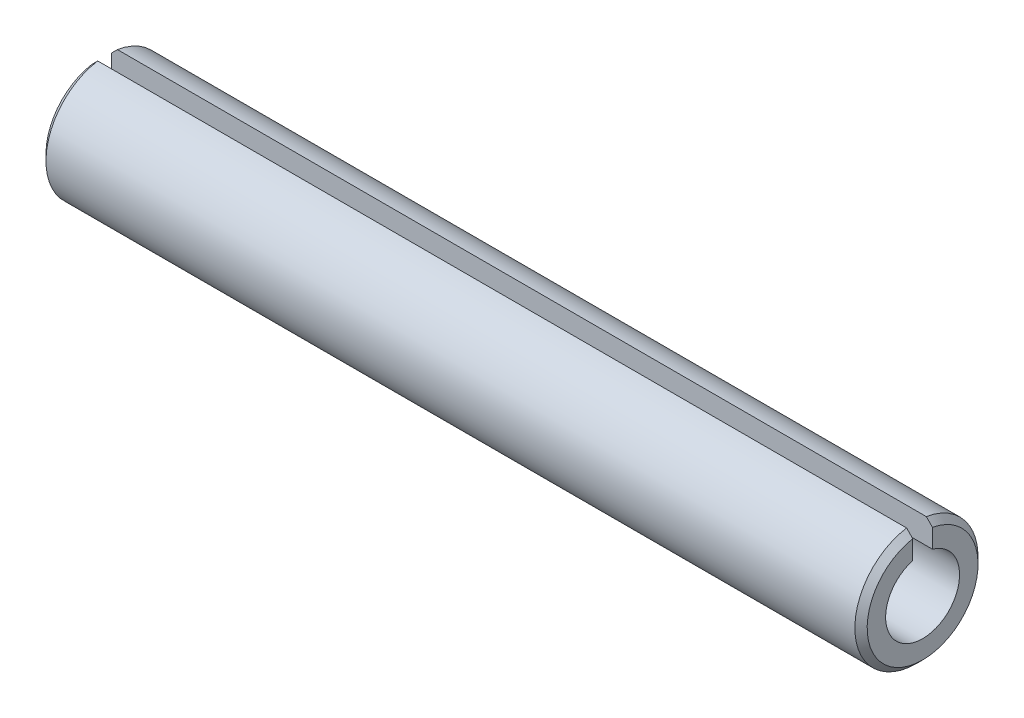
SolidWorks part; units mm, degrees
ref_plane "Plan1" through (0, 0, 0) normal (0, 0, 1) x (1, 0, 0)
ref_plane "Plan2" through (0, 0, 0) normal (0, 1, 0) x (1, 0, 0)
ref_plane "Plan3" through (0, 0, 0) normal (1, 0, 0) x (0, 0, -1)
sketch "Esquisse1" plane through (0, 0, 0) normal (0, 0, 1) x (1, 0, 0)
  line L0 (0, 1.8) -> (0, 2.7)
  line L1 (0, 1.8) -> (40, 1.8)
  line L2 (40, 1.8) -> (40, 2.7)
  line L3 (40, 2.7) -> (39.7, 3)
  line L4 (39.7, 3) -> (0.3, 3)
  line L5 (0.3, 3) -> (0, 2.7)
  line L6 (0, 0) -> (40, 0) construction
  dimension "D1" = 40
  dimension "D2" = 3
  dimension "D3" = 1.2
  dimension "D4" = 45
  dimension "D5" = 45
  dimension "D6" = 0.3
revolve "Base-Révolution" add sketch "Esquisse1" angle 360 about L6
sketch "Esquisse2" plane through (0, 0, 0) normal (1, 0, 0) x (0, 0, -1)
  line L0 (0, 0) -> (0, 3) construction
  line L1 (0.48, 2.9614) -> (0.48, 1.7348)
  line L2 (-0.48, 2.9614) -> (-0.48, 1.7348)
  circle A0 centre (0, 0) radius 3 construction
  circle A1 centre (0, 0) radius 1.8 construction
  arc A2 (0.48, 1.7348) -> (-0.48, 1.7348) centre (0, 0) ccw
  arc A3 (0.48, 2.9614) -> (-0.48, 2.9614) centre (0, 0) ccw
  dimension "D1" = 0.48
extrude "Enlèv. mat.-Extru.2" cut sketch "Esquisse2" along normal through all
equation "\"D6@Esquisse1\"=\"D2@Esquisse1\"/10"
equation "\"D1@Esquisse2\"=\"D3@Esquisse1\"/2.5"
